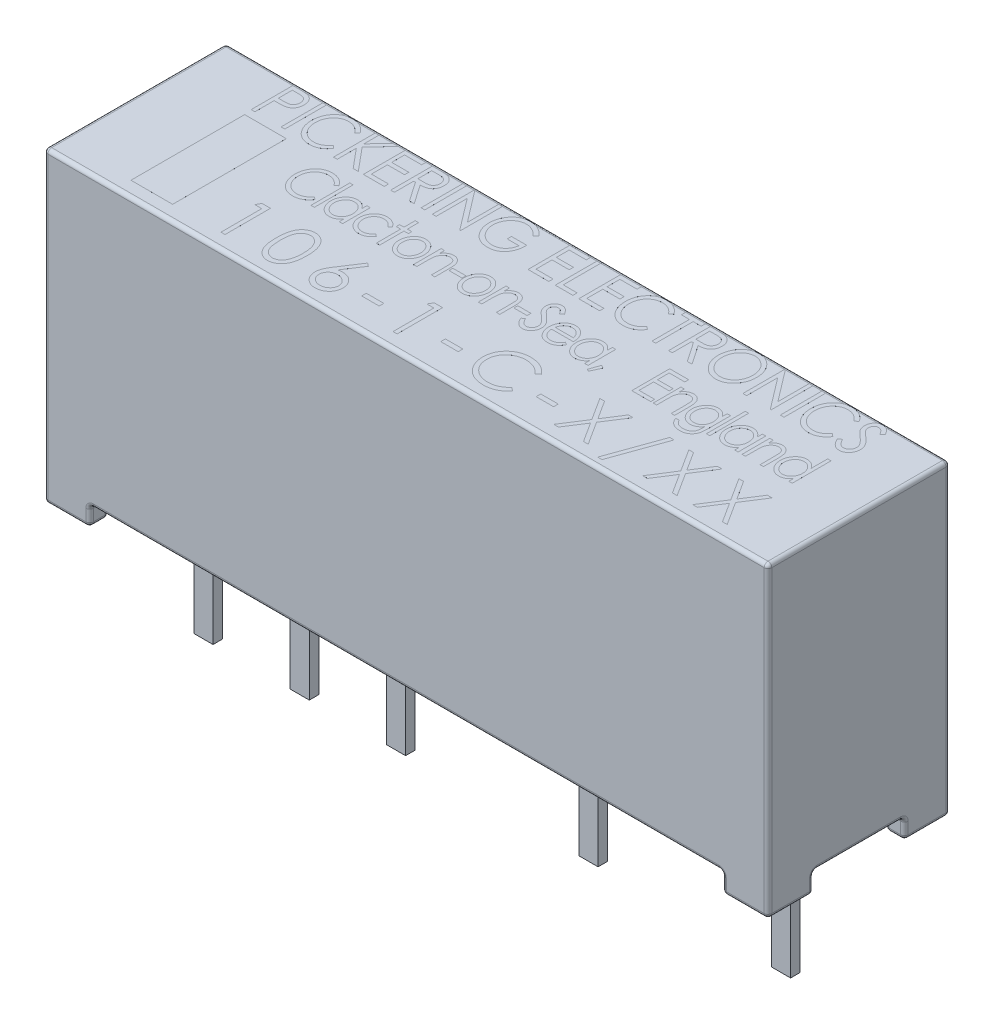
SolidWorks part; units mm, degrees
ref_plane "Front Plane" through (0, 0, 0) normal (0, 0, 1) x (1, 0, 0)
ref_plane "Top Plane" through (0, 0, 0) normal (0, 1, 0) x (1, 0, 0)
ref_plane "Right Plane" through (0, 0, 0) normal (1, 0, 0) x (0, 0, -1)
sketch "Sketch1" plane through (0, 0, 0) normal (0, 1, 0) x (1, 0, 0)
  line L1 (9.55, -2.4) -> (-9.55, -2.4)
  line L2 (9.55, -2.4) -> (9.55, 2.4)
  line L3 (9.55, 2.4) -> (-9.55, 2.4)
  line L4 (-9.55, -2.4) -> (-9.55, 2.4)
  line L5 (9.55, -2.4) -> (-9.55, 2.4) construction
  line L6 (9.55, 2.4) -> (-9.55, -2.4) construction
  point P0 (0, 0)
  dimension "D1" = 4.8
  dimension "D2" = 19.1
extrude "Main Body" add sketch "Sketch1" along normal blind 7.592
sketch "Sketch2" plane through (0, 0, 0) normal (0, -1, 0) x (1, 0, 0)
  line L1 (-9.55, 2.4) -> (-8.35, 2.4)
  line L2 (-9.55, 2.4) -> (-9.55, 1.2)
  line L3 (-9.55, 1.2) -> (-9.05, 1.2)
  line L4 (-8.35, 2.4) -> (-8.35, 1.9)
  line L7 (-8.35, 1.9) -> (-9.05, 1.9)
  line L8 (-9.05, 1.2) -> (-9.05, 1.9)
  dimension "D1" = 1.2
  dimension "D2" = 1.2
  dimension "D3" = 0.5
  dimension "D4" = 0.5
extrude "Original Foot" add sketch "Sketch2" along normal blind 0.508
mirror "Left Foot" about plane through (0, 0, 0) normal (0, 0, 1) of "Original Foot"
mirror "Right Feet" about plane through (0, 0, 0) normal (1, 0, 0) of "Left Foot", "Original Foot"
sketch "Sketch3" plane through (0, 0, 0) normal (0, -1, 0) x (1, 0, 0)
  line L0 (9.55, 1.2) -> (9.55, -1.2) construction
  line L1 (-7.366, -0.127) -> (-7.874, -0.127)
  line L2 (-7.366, -0.127) -> (-7.366, 0.127)
  line L3 (-7.366, 0.127) -> (-7.874, 0.127)
  line L4 (-7.874, -0.127) -> (-7.874, 0.127)
  line L5 (-7.366, -0.127) -> (-7.874, 0.127) construction
  line L6 (-7.366, 0.127) -> (-7.874, -0.127) construction
  line L7 (-2.286, -0.127) -> (-2.794, -0.127)
  line L8 (-2.286, -0.127) -> (-2.286, 0.127)
  line L9 (-2.286, 0.127) -> (-2.794, 0.127)
  line L10 (-2.794, -0.127) -> (-2.794, 0.127)
  line L11 (-2.286, -0.127) -> (-2.794, 0.127) construction
  line L12 (-2.286, 0.127) -> (-2.794, -0.127) construction
  line L13 (2.794, -0.127) -> (2.286, -0.127)
  line L14 (2.794, -0.127) -> (2.794, 0.127)
  line L15 (2.794, 0.127) -> (2.286, 0.127)
  line L16 (2.286, -0.127) -> (2.286, 0.127)
  line L17 (2.794, -0.127) -> (2.286, 0.127) construction
  line L18 (2.794, 0.127) -> (2.286, -0.127) construction
  line L19 (7.874, -0.127) -> (7.366, -0.127)
  line L20 (7.874, -0.127) -> (7.874, 0.127)
  line L21 (7.874, 0.127) -> (7.366, 0.127)
  line L22 (7.366, -0.127) -> (7.366, 0.127)
  line L23 (7.874, -0.127) -> (7.366, 0.127) construction
  line L24 (7.874, 0.127) -> (7.366, -0.127) construction
  line L27 (-5.334, -0.127) -> (-4.826, -0.127)
  line L28 (-5.334, -0.127) -> (-5.334, 0.127)
  line L29 (-5.334, 0.127) -> (-4.826, 0.127)
  line L30 (-4.826, -0.127) -> (-4.826, 0.127)
  line L31 (-5.334, -0.127) -> (-4.826, 0.127) construction
  line L32 (-5.334, 0.127) -> (-4.826, -0.127) construction
  point P0 (-7.62, 0)
  point P5 (-2.54, 0)
  point P10 (2.54, 0)
  point P15 (7.62, 0)
  point P23 (-5.08, 0)
  dimension "D1" = 0.254
  dimension "D2" = 0.508
  dimension "D3" = 0.254
  dimension "D4" = 0.508
  dimension "D5" = 0.254
  dimension "D6" = 0.508
  dimension "D7" = 0.508
  dimension "D8" = 0.254
  dimension "D9" = 5.08
  dimension "D10" = 5.08
  dimension "D11" = 5.08
  dimension "D12" = 1.93
  dimension "D13" = 0.508
  dimension "D14" = 2.54
extrude "Pins" add sketch "Sketch3" along normal blind 3.808
sketch "Sketch4"
  dimension "D1" = 15.6
  dimension "D2" = 1.75
  dimension "D3" = 13.5
  dimension "D4" = 1.2
  dimension "D5" = 1.4
  dimension "D6" = 1.8
  dimension "D7" = 3
  dimension "D8" = 1.1
  dimension "D9" = 0.4
extrude "Lettering" add sketch "Sketch4" along normal blind 0.0001
fillet "Fillet1" radius 0.1 72 edges at (8.35, -0.254, -2.4) (8.35, -0.254, -1.9) (9.05, -0.254, -1.2) (9.55, -0.254, -1.2) (9.55, -0.254, 1.2) (9.05, -0.254, 1.2) (8.35, -0.254, 1.9) (8.35, -0.254, 2.4) (-9.55, -0.254, -1.2) (-9.05, -0.254, -1.2) (8.35, 0, -2.15) (9.3, 0, -1.2) (9.3, 0, 1.2) (8.35, 0, 2.15) (-9.3, 0, -1.2) (-8.7, 0, -1.9) (8.7, 0, -1.9) (9.05, -0.254, -1.9) (9.05, 0, -1.55) (9.05, 0, 1.55) (9.05, -0.254, 1.9) (8.7, 0, 1.9) (-8.35, -0.254, 1.9) (-8.7, 0, 1.9) (-9.05, -0.254, 1.2) (-9.05, -0.254, 1.9) (-9.05, 0, 1.55) (-9.05, -0.254, -1.9) (-9.05, 0, -1.55) (-8.35, -0.254, -2.4) (-8.35, -0.254, -1.9) (-8.35, 0, -2.15) (-9.3, -0.508, -1.2) (-9.05, -0.508, -1.55) (-8.7, -0.508, -1.9) (-8.35, -0.508, -2.15) (-8.95, -0.508, -2.4) (-9.55, -0.508, -1.8) (-8.95, -0.508, 2.4) (-8.35, -0.508, 2.15) (-8.7, -0.508, 1.9) (-9.05, -0.508, 1.55) (-9.3, -0.508, 1.2) (-9.55, -0.508, 1.8) (8.95, -0.508, -2.4) (8.35, -0.508, -2.15) (8.7, -0.508, -1.9) (9.05, -0.508, -1.55) (9.3, -0.508, -1.2) (9.55, -0.508, -1.8) (9.3, -0.508, 1.2) (9.05, -0.508, 1.55) (8.7, -0.508, 1.9) (8.35, -0.508, 2.15) (8.95, -0.508, 2.4) (9.55, -0.508, 1.8) (9.55, 0, 0) (0, 0, -2.4) (9.55, 3.542, 2.4) (0, 7.592, 2.4) (0, 7.592, -2.4) (9.55, 7.592, 0) (9.55, 3.542, -2.4) (-9.55, 7.592, 0) (-9.55, 3.542, -2.4) (-9.55, 3.542, 2.4)
